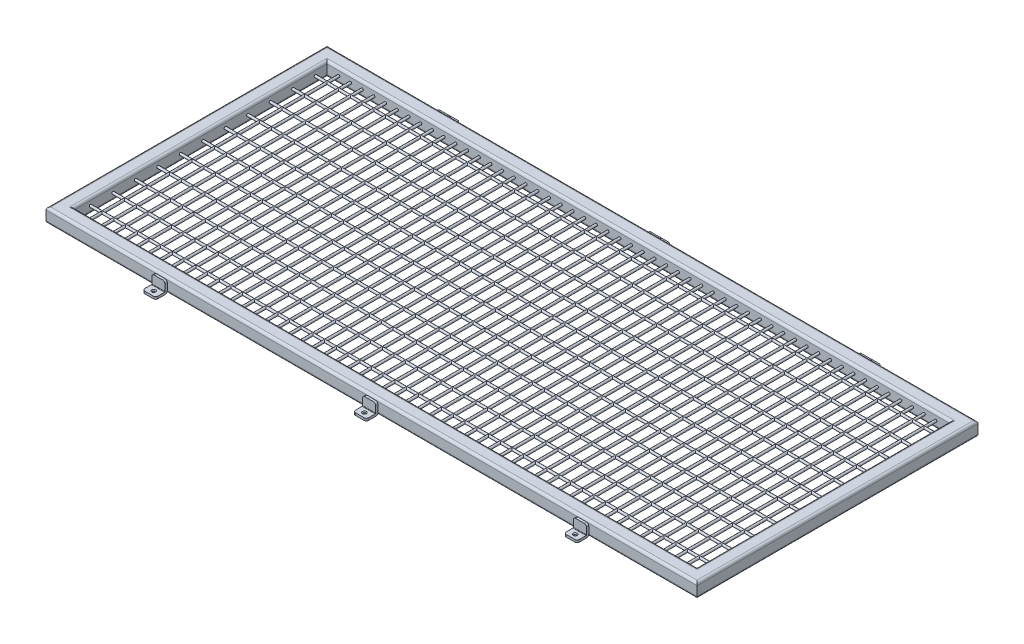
SolidWorks part; units mm, degrees
ref_plane "Front Plane" through (0, 0, 0) normal (0, 0, 1) x (1, 0, 0)
ref_plane "Top Plane" through (0, 0, 0) normal (0, 1, 0) x (1, 0, 0)
ref_plane "Right Plane" through (0, 0, 0) normal (1, 0, 0) x (0, 0, -1)
sketch "Sketch1" plane through (0, 0, 0) normal (0, 1, 0) x (1, 0, 0)
  line L1 (680, -285) -> (-680, -285)
  line L2 (680, -285) -> (680, 285)
  line L3 (680, 285) -> (-680, 285)
  line L4 (-680, -285) -> (-680, 285)
  line L5 (680, -285) -> (-680, 285) construction
  line L6 (680, 285) -> (-680, -285) construction
  point P0 (0, 0)
  dimension "护栏长" = 1360
  dimension "D2" = 570
other "Structural Member1"
ref_plane "Plane1" through (-680, 0, 285) normal (0, 0, -1) x (-1, 0, 0)
sketch "Sketch13" plane through (-680, 0, 285) normal (0, 0, -1) x (-1, 0, 0)
  line L0 (-9.8, -12.4) -> (9.8, -12.4)
  line L1 (-12.4, -9.8) -> (-12.4, 9.8)
  line L2 (9.8, 12.4) -> (-9.8, 12.4)
  line L3 (12.4, 9.8) -> (12.4, -9.8)
  line L4 (-9.8, -15) -> (9.8, -15)
  line L5 (-15, -9.8) -> (-15, 9.8)
  line L6 (9.8, 15) -> (-9.8, 15)
  line L7 (15, 9.8) -> (15, -9.8)
  arc A0 (15, 9.8) -> (9.8, 15) centre (9.8, 9.8) ccw
  arc A1 (9.8, -15) -> (15, -9.8) centre (9.8, -9.8) ccw
  arc A2 (-15, -9.8) -> (-9.8, -15) centre (-9.8, -9.8) ccw
  arc A3 (-9.8, 15) -> (-15, 9.8) centre (-9.8, 9.8) ccw
  arc A4 (-9.8, 12.4) -> (-12.4, 9.8) centre (-9.8, 9.8) ccw
  arc A5 (12.4, 9.8) -> (9.8, 12.4) centre (9.8, 9.8) ccw
  arc A6 (9.8, -12.4) -> (12.4, -9.8) centre (9.8, -9.8) ccw
  arc A7 (-12.4, -9.8) -> (-9.8, -12.4) centre (-9.8, -9.8) ccw
  point P0 (-15, 0)
  point P1 (15, 0)
  point P2 (0, 15)
  point P3 (0, -15)
  point P4 (0, 0)
  point P5 (-15, -15)
  point P6 (15, -15)
  point P7 (15, 15)
  point P8 (-15, 15)
  point P33 (0, 0)
  dimension "D1" = 5.2
  dimension "Thickness" = 2.6
  dimension "V_leg" = 30
sketch "Sketch14" plane through (0, 0, 0) normal (1, 0, 0) x (0, 0, -1)
  line L0 (300, 9.8) -> (300, -10)
  line L1 (305, -15) -> (325, -15)
  line L2 (325, -15) -> (325, -10)
  line L3 (325, -10) -> (306, -10)
  line L4 (305, -9) -> (305, 9.8)
  line L5 (305, 9.8) -> (300, 9.8)
  line L6 (-294.8, -15) -> (294.8, -15) construction
  arc A0 (300, -10) -> (305, -15) centre (305, -10) ccw
  arc A1 (305, -9) -> (306, -10) centre (306, -9) ccw
  point P11 (300, -15)
  dimension "D3" = 5
  dimension "D4" = 1
  dimension "D1" = 5
  dimension "D2" = 25
extrude "Boss-Extrude1" add sketch "Sketch14" along normal mid plane 28 separate body
fillet "Fillet1" radius 5 4 edges at (14, 9.8, -302.5) (-14, 9.8, -302.5) (-14, -12.5, -325) (14, -12.5, -325)
pattern_linear "LPattern1" count 2 spacing 450 along (1, 0, 0)
pattern_linear "LPattern2" count 2 spacing 450 along (-1, 0, 0)
mirror "Mirror1" about plane through (0, 0, 0) normal (0, 0, 1)
sketch "Sketch17" plane through (0, -10, 0) normal (0, 1, 0) x (1, 0, 0)
  line L0 (-450, 325) -> (-450, 315) construction
  line L1 (-441, 325) -> (-459, 325) construction
  line L2 (450, -325) -> (450, -315) construction
  line L3 (-450, 315) -> (450, 315)
  line L4 (-450, 315) -> (-450, -315)
  line L5 (-450, -315) -> (450, -315)
  line L6 (450, 315) -> (450, -315)
  line L7 (459, -325) -> (441, -325) construction
  line L8 (0, -315) -> (0, -325) construction
  line L9 (9, -325) -> (-9, -325) construction
  line L10 (0, 325) -> (0, 315) construction
  line L11 (9, 325) -> (-9, 325) construction
  dimension "D1" = 10
  dimension "D2" = 10
hole_wizard "CSK for #8 Flat Head Machine Screw (100)1" positions "Sketch16" profile "Sketch15" countersink size "#8" standard "Ansi Inch"
sketch "Sketch16" plane through (0, -10, 0) normal (0, 1, 0) x (-1, 0, 0)
  point P0 (450, -315)
  point P1 (0, -315)
  point P3 (-450, -315)
  point P5 (-450, 315)
  point P7 (0, 315)
  point P9 (450, 315)
sketch "Sketch15" plane through (-450, -10, -315) normal (1, 0, 0) x (0, 0, 1)
  line L0 (0, 0) -> (0, 5)
  line L1 (0, 5) -> (2.2479, 5)
  line L2 (2.2479, 5) -> (2.2479, 1.6518)
  line L3 (2.2479, 1.6518) -> (4.2164, 0)
  line L5 (4.2164, 0) -> (0, 0)
  line L6 (-2.2479, 1.6518) -> (-4.2164, 0) construction
  line L11 (0, -6.35) -> (0, 107.95) construction
  dimension "Thru Hole Dia." = 4.4958
  dimension "Thru Hole Depth" = 5
  dimension "Near C'Sink Dia." = 8.4328
  dimension "Near C'Sink Angle" = 100
sketch "Sketch18" plane through (-665, 0, 0) normal (1, 0, 0) x (0, 0, -1)
  line L0 (270, 0) -> (245, 0) construction
  line L1 (270, 9.8) -> (270, -9.8) construction
  circle A0 centre (245, 0) radius 2.5
  dimension "D1" = 5
  dimension "D2" = 25
extrude "Boss-Extrude2" add sketch "Sketch18" along normal up to next
pattern_linear "LPattern3" count 11 spacing 48 along (0, 0, 1) of "Boss-Extrude2"
sketch "Sketch19" plane through (0, 0, -270) normal (0, 0, 1) x (1, 0, 0)
  line L0 (-665, 0) -> (-640, 0) construction
  line L1 (-665, 9.8) -> (-665, -9.8) construction
  circle A0 centre (-640, 0) radius 2.5
  point P0 (-665, 0)
  dimension "D2" = 5
  dimension "D1" = 25
extrude "Boss-Extrude3" add sketch "Sketch19" along normal up to surface (540 mm away)
pattern_linear "LPattern4" count 52 spacing 25 along (1, 0, 0) of "Boss-Extrude3"
